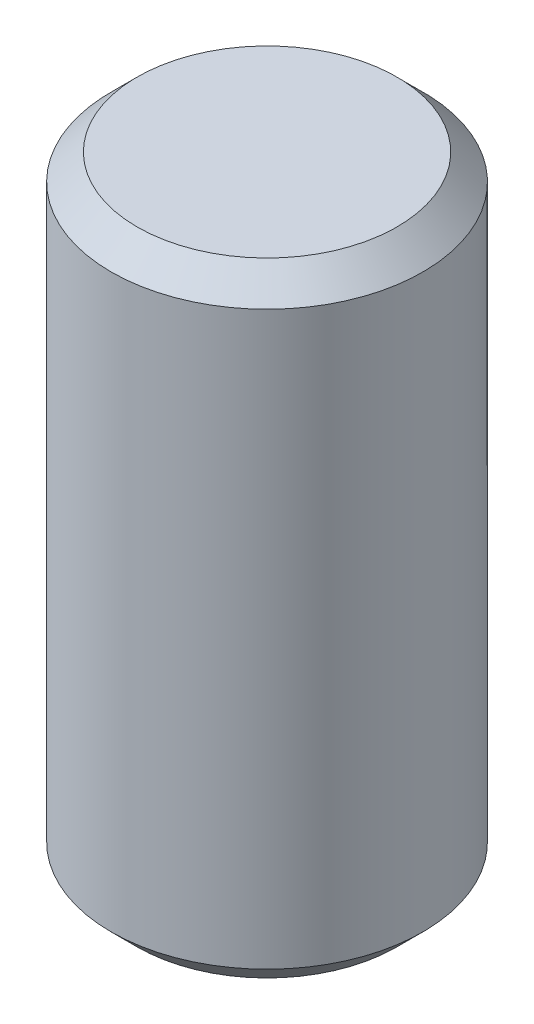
SolidWorks part; units mm, degrees
ref_plane "Front Plane" through (0, 0, 0) normal (0, 0, 1) x (1, 0, 0)
ref_plane "Top Plane" through (0, 0, 0) normal (0, 1, 0) x (1, 0, 0)
ref_plane "Right Plane" through (0, 0, 0) normal (1, 0, 0) x (0, 0, -1)
sketch "Sketch1" plane through (0, 0, 0) normal (0, 1, 0) x (1, 0, 0)
  circle A0 centre (0, 0) radius 1.5
  dimension "D1" = 3
extrude "Boss-Extrude1" add sketch "Sketch1" along normal blind 6
chamfer "Chamfer1" distance 0.25 angle 45 2 edges at (0, 0, 1.5) (0, 6, 1.5)
